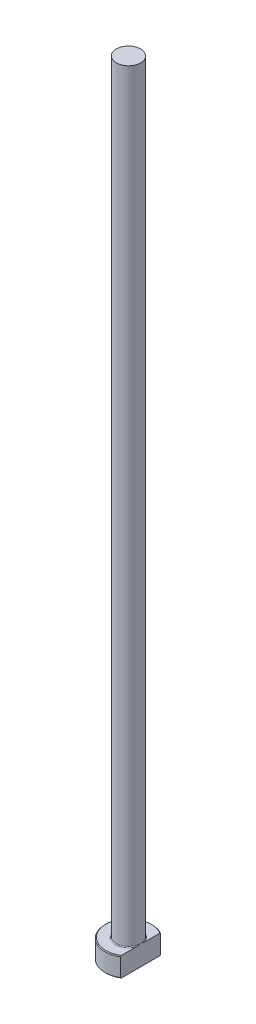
SolidWorks part; units mm, degrees
ref_plane "Front Plane" through (0, 0, 0) normal (0, 0, 1) x (1, 0, 0)
ref_plane "Top Plane" through (0, 0, 0) normal (0, 1, 0) x (1, 0, 0)
ref_plane "Right Plane" through (0, 0, 0) normal (1, 0, 0) x (0, 0, -1)
sketch "Sketch1" plane through (0, 0, 0) normal (0, 0, 1) x (1, 0, 0)
  line L0 (0, 259.9588) -> (0, -15.1925) construction
  line L1 (0, 0) -> (-6, 0)
  line L2 (-6, 0) -> (-6, 5)
  line L3 (-6, 5) -> (-3.1, 5)
  line L4 (-3.1, 5) -> (-3.1, 200)
  line L5 (-3.1, 200) -> (0, 200)
  line L6 (0, 200) -> (0, 0)
  dimension "L" = 200
  dimension "H" = 12
  dimension "T" = 5
  dimension "D" = 6.2
revolve "Revolve1" add sketch "Sketch1" angle 360 about L0
chamfer "Chamfer1" distance 0.2 angle 45 2 edges at (0, 5, 6) (0, 0, 6)
fillet "Fillet1" radius 0.2 1 edges at (0, 5, 3.1)
sketch "Sketch2" plane through (0, 0, 0) normal (0, 1, 0) x (1, 0, 0)
  line L0 (3.1, 5.1371) -> (3.1, -5.1371)
  circle A0 centre (0, 0) radius 6 construction
  arc A1 (3.1, -5.1371) -> (3.1, 5.1371) centre (0, 0) ccw
  circle A2 centre (0, 0) radius 3.1 construction
extrude "KEY" cut sketch "Sketch2" along normal through all
